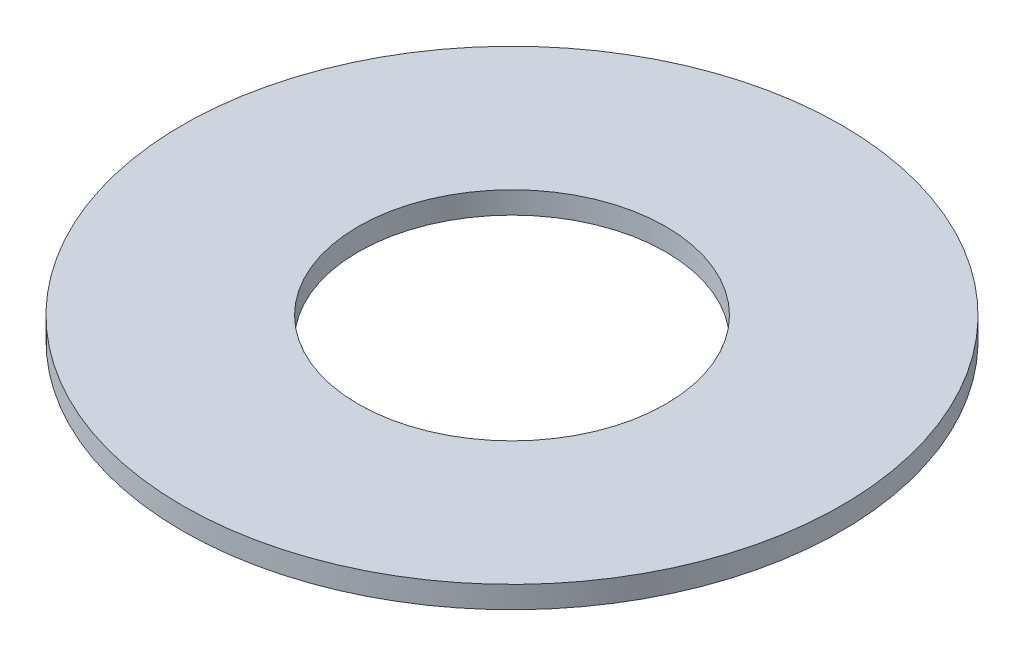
SolidWorks part; units mm, degrees
ref_plane "Plan de face" through (0, 0, 0) normal (0, 0, 1) x (1, 0, 0)
ref_plane "Plan de dessus" through (0, 0, 0) normal (0, 1, 0) x (1, 0, 0)
ref_plane "Plan de droite" through (0, 0, 0) normal (1, 0, 0) x (0, 0, -1)
sketch "Esquisse1" plane through (0, 0, 0) normal (0, 1, 0) x (1, 0, 0)
  circle A0 centre (0, 0) radius 7
  circle A1 centre (0, 0) radius 15
  dimension "D1" = 14
  dimension "D2" = 30
extrude "Extrusion1" add sketch "Esquisse1" along normal blind 1
